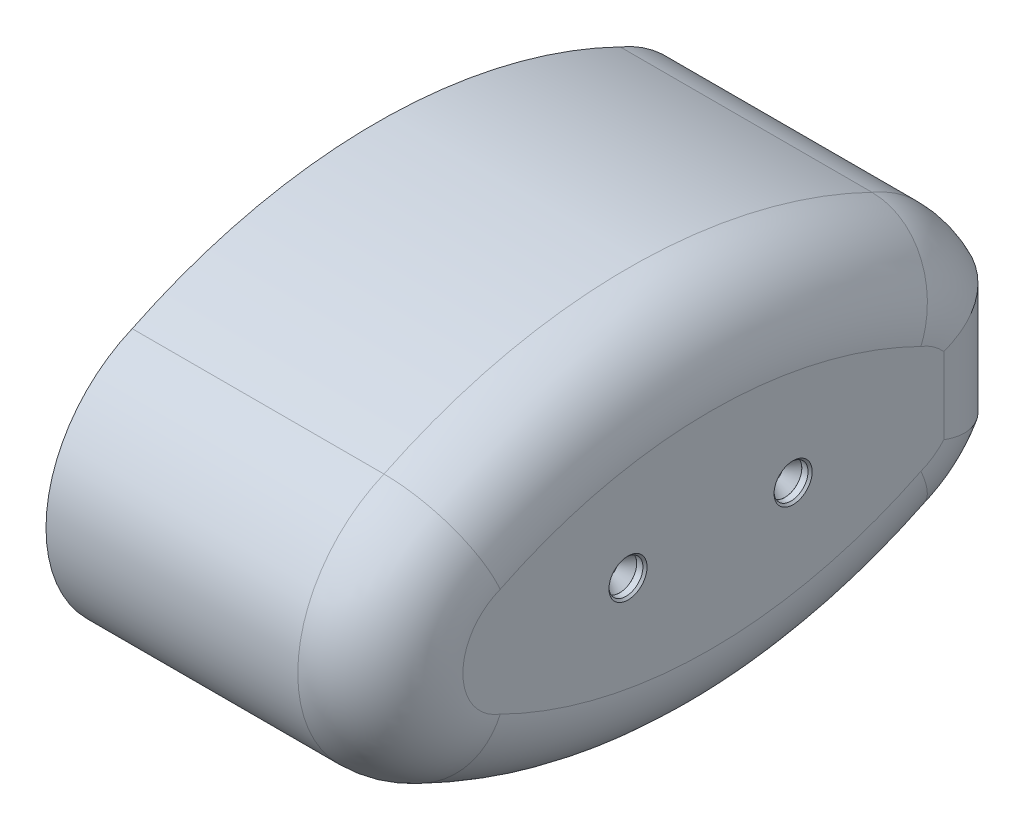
SolidWorks part; units mm, degrees
ref_plane "Front" through (0, 0, 0) normal (0, 0, 1) x (1, 0, 0)
ref_plane "Top" through (0, 0, 0) normal (0, 1, 0) x (1, 0, 0)
ref_plane "Right" through (0, 0, 0) normal (1, 0, 0) x (0, 0, -1)
sketch "Sketch1" plane through (0, 0, 0) normal (1, 0, 0) x (0, 0, -1)
  line L0 (0, 45) -> (0, 0) construction
  line L1 (0, 0) -> (0, -22.5) construction
  line L2 (-29.559, -15.6837) -> (29.559, -15.6837) construction
  line L3 (0, 0) -> (-32.5, 0) construction
  line L4 (38.2561, 7.5) -> (38.2561, -7.5)
  arc A0 (0, -22.5) -> (-29.559, -15.6837) centre (0, 45) cw
  arc A1 (0, -22.5) -> (29.559, -15.6837) centre (0, 45) ccw
  arc A2 (0, 22.5) -> (-29.559, 15.6837) centre (0, -45) ccw
  arc A3 (0, 22.5) -> (29.559, 15.6837) centre (0, -45) cw
  arc A4 (-29.559, -15.6837) -> (-29.559, 15.6837) centre (-23, 0) cw
  arc A5 (29.559, -15.6837) -> (38.2561, -7.5) centre (23, 0) ccw
  arc A6 (38.2561, 7.5) -> (29.559, 15.6837) centre (23, 0) ccw
  dimension "D5" = 23
  dimension "D4" = 17
  dimension "D1" = 45
  dimension "D2" = 22.5
  dimension "D3" = 32.5
  dimension "D6" = 15
extrude "Extrude1" add sketch "Sketch1" along normal blind 40.5
fillet "Fillet5" radius 10 6 edges at (40.5, -12.3807, -34.6498) (40.5, 0, -38.2561) (40.5, 12.3807, -34.6498) (40.5, 22.5, 0) (40.5, 0, 40) (40.5, -22.5, 0)
shell "Shell2" thickness 2
sketch "Sketch2" plane through (40.5, 0, 0) normal (1, 0, 0) x (0, 0, -1)
  line L0 (0, 0) -> (-17.9366, 0) construction
  line L1 (0, 0) -> (0, 9.1655) construction
  circle A0 centre (-10, 0) radius 2.0574
  circle A1 centre (10, 0) radius 2.0574
  dimension "D1" = 4.1148
  dimension "D2" = 10
extrude "Cut-Extrude1" cut sketch "Sketch2" against normal through all
sketch "Sketch3" plane through (38.5, 0, 0) normal (1, 0, 0) x (0, 0, -1)
  circle A0 centre (-10, 0) radius 4.0574
  circle A1 centre (10, 0) radius 4.0574
  circle A2 centre (-10, 0) radius 2.0574 construction
  dimension "D1" = 2
extrude "Extrude2" add sketch "Sketch3" against normal mid plane 2
sketch "Sketch4" plane through (39.5, 0, 0) normal (1, 0, 0) x (0, 0, -1)
  circle A0 centre (-10, 0) radius 0.9652
  circle A1 centre (10, 0) radius 0.9652
  circle A2 centre (-10, 0) radius 2.0574 construction
  circle A3 centre (10, 0) radius 2.0574 construction
  dimension "D1" = 1.9304
extrude "Cut-Extrude2" cut sketch "Sketch4" against normal through all
chamfer "Chamfer1" distance 1.25 angle 41 2 edges at (39.5, 0, 9.0348) (39.5, 0, -10.9652)
chamfer "Chamfer2" distance 0.25 angle 45 2 edges at (40.5, 0, 7.9426) (40.5, 0, -7.9426)
